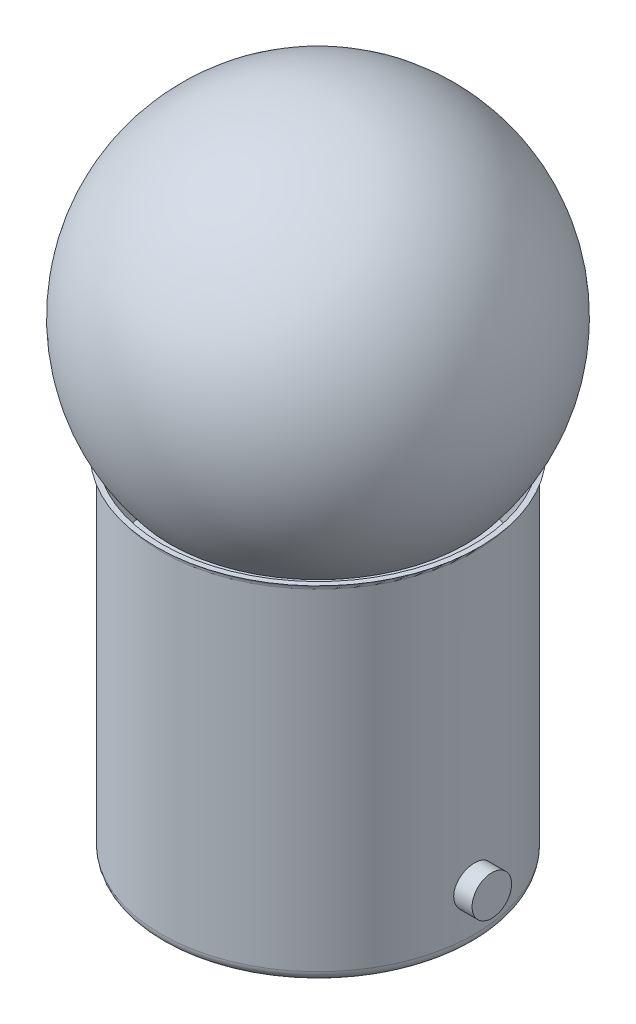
SolidWorks part; units mm, degrees
ref_plane "Front Plane" through (0, 0, 0) normal (0, 0, 1) x (1, 0, 0)
ref_plane "Top Plane" through (0, 0, 0) normal (0, 1, 0) x (1, 0, 0)
ref_plane "Right Plane" through (0, 0, 0) normal (1, 0, 0) x (0, 0, -1)
sketch "Sketch1" plane through (0, 0, 0) normal (0, 1, 0) x (1, 0, 0)
  circle A0 centre (0, 0) radius 7.5565
  dimension "D1" = 15.113
extrude "Boss-Extrude1" add sketch "Sketch1" along normal blind 16.4846
sketch "Sketch2" plane through (0, 0, 0) normal (1, 0, 0) x (0, 0, -1)
  line L0 (7.5565, 0) -> (7.5565, 16.4846) construction
  line L1 (7.5565, 14.0954) -> (7.5565, 16.4846)
  line L2 (7.768, 16.7711) -> (7.5111, 16.7711)
  line L3 (7.5111, 16.7711) -> (7.5111, 14.0954)
  line L4 (7.5111, 14.0954) -> (7.5565, 14.0954)
  arc A0 (7.5565, 16.4846) -> (7.768, 16.7711) centre (7.8564, 16.4846) cw
revolve "Revolve1" add sketch "Sketch2" angle 360 about axis through (0, 16.4846, 0) along (0, -1, 0)
fillet "Fillet1" radius 0.508 1 edges at (0, 0, 7.5565)
sketch "Sketch3" plane through (0, 0, 0) normal (1, 0, 0) x (0, 0, -1)
  line L0 (0, 0) -> (0, -2.6119) construction
  line L1 (3.8862, 0) -> (1.062, -2.744)
  line L2 (-7.0485, 0) -> (7.0485, 0) construction
  line L3 (0, 16.4846) -> (0, 0.508) construction
  line L4 (0, 0) -> (3.8862, 0)
  line L5 (0, -3.175) -> (0, 0)
  arc A0 (0, -3.175) -> (1.062, -2.744) centre (0, -1.651) ccw
  dimension "D2" = 3.175
  dimension "D3" = 3.048
  dimension "D1" = 3.8862
revolve "Revolve2" add sketch "Sketch3" angle 360 about L0
sketch "Sketch4" plane through (0, 0, 0) normal (1, 0, 0) x (0, 0, -1)
  line L0 (-3.8862, 0) -> (3.8862, 0) construction
  circle A0 centre (0, 2.54) radius 0.9525
  dimension "D1" = 1.905
  dimension "D2" = 2.54
extrude "Boss-Extrude2" add sketch "Sketch4" along normal blind 8.382 and the other way blind 8.4582
sketch "Sketch5" plane through (0, 16.4846, 0) normal (0, 1, 0) x (1, 0, 0)
  circle A0 centre (0, 0) radius 7.5111 construction
  circle A1 centre (0, 0) radius 7.5111
extrude "Cut-Extrude1" cut sketch "Sketch5" against normal blind 5.4356
sketch "Sketch6" plane through (0, 0, 0) normal (1, 0, 0) x (0, 0, -1)
  line L0 (0, 31.75) -> (-6.2998, 31.75) construction
  line L1 (0, 16.564) -> (7.1118, 16.564)
  line L3 (0, 12.09) -> (0, 25.2738) construction
  line L4 (0, 16.564) -> (0, 31.75)
  line L5 (-3.8862, 0) -> (3.8862, 0) construction
  arc A0 (0, 31.75) -> (7.1118, 16.564) centre (0, 22.4917) cw
  dimension "D1" = 9.2583
  dimension "D2" = 15.186
  dimension "D3" = 31.75
revolve "Revolve3" add sketch "Sketch6" angle 360 about axis through (0, 16.4846, 0) along (0, -1, 0)
